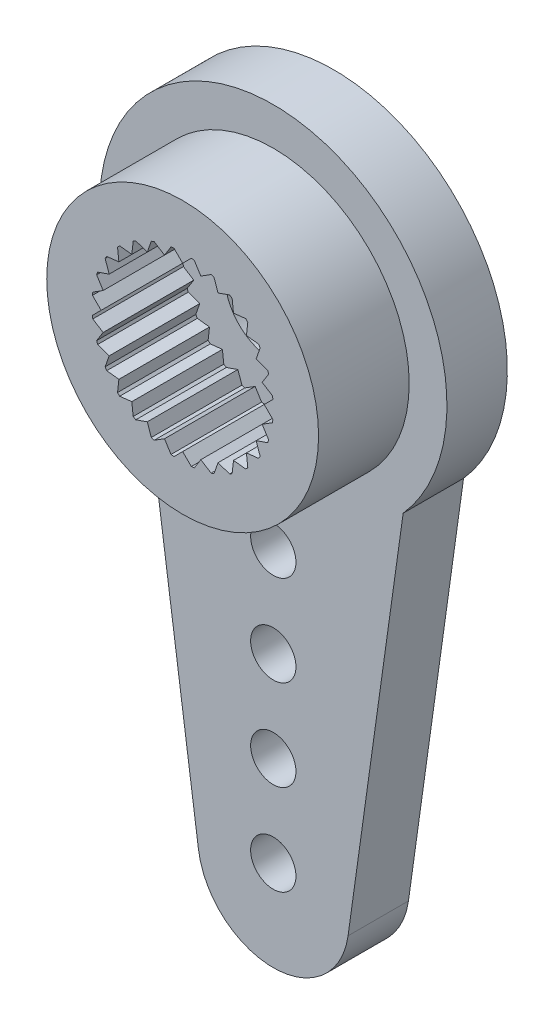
SolidWorks part; units mm, degrees
ref_plane "Plan de face" through (0, 0, 0) normal (0, 0, 1) x (1, 0, 0)
ref_plane "Plan de dessus" through (0, 0, 0) normal (0, 1, 0) x (1, 0, 0)
ref_plane "Plan de droite" through (0, 0, 0) normal (1, 0, 0) x (0, 0, -1)
sketch "Esquisse1" plane through (0, 0, 0) normal (0, 0, 1) x (1, 0, 0)
  circle A0 centre (0, 0) radius 5.75
  circle A1 centre (0, 0) radius 1.6
  dimension "D1" = 11.5
  dimension "D2" = 3.2
extrude "Boss.-Extru.1" add sketch "Esquisse1" along normal blind 5
sketch "Esquisse2" plane through (0, 0, 5) normal (0, 0, 1) x (1, 0, 0)
  circle A0 centre (0, 0) radius 3
  dimension "D1" = 6
extrude "Enlèv. mat.-Extru.1" cut sketch "Esquisse2" against normal blind 3
sketch "Esquisse3" plane through (0, 0, 5) normal (0, 0, 1) x (1, 0, 0)
  circle A0 centre (0, 0) radius 5.75
  circle A1 centre (0, 0) radius 4.5
  circle A2 centre (0, 0) radius 3 construction
  circle A3 centre (0, 0) radius 5.75 construction
  dimension "D1" = 1.5
extrude "Enlèv. mat.-Extru.2" cut sketch "Esquisse3" against normal blind 3
sketch "Esquisse4" plane through (0, 0, 0) normal (0, 0, -1) x (-1, 0, 0)
  line L0 (-4.3, 3.8174) -> (-2.4759, 16.8466)
  line L1 (2.4759, 16.8466) -> (4.3, 3.8174)
  line L2 (-5.2729, 19) -> (6.8365, 19) construction
  line L3 (0, 0) -> (0, 24.2526) construction
  circle A0 centre (0, 0) radius 5.75 construction
  arc A1 (-2.4759, 16.8466) -> (2.4759, 16.8466) centre (0, 16.5) cw
  arc A2 (-4.3, 3.8174) -> (4.3, 3.8174) centre (0, 0) cw
  dimension "D2" = 2.5
  dimension "D1" = 8.6
  dimension "D3" = 19
extrude "Boss.-Extru.2" add sketch "Esquisse4" against normal up to surface (2 mm away)
pattern_circular "Répétition circulaire1" count 2 every 180 about axis through (0, 0, 0) along (0, 0, 1) of "Boss.-Extru.2"
sketch "Esquisse5" plane through (0, 0, 0) normal (0, 0, -1) x (-1, 0, 0)
  line L0 (0, 0) -> (0, 20.4605) construction
  circle A0 centre (0, 7) radius 0.75
  circle A1 centre (0, 10) radius 0.75
  circle A2 centre (0, 13) radius 0.75
  circle A3 centre (0, 16) radius 0.75
  dimension "D5" = 1.5
  dimension "D6" = 1.5
  dimension "D7" = 1.5
  dimension "D8" = 1.5
  dimension "D1" = 7
  dimension "D2" = 3
  dimension "D3" = 3
  dimension "D4" = 3
extrude "Enlèv. mat.-Extru.3" cut sketch "Esquisse5" against normal blind 3
pattern_circular "Répétition circulaire2" count 2 every 180 about axis through (0, 0, 0) along (0, 0, 1) of "Enlèv. mat.-Extru.3"
sketch "Esquisse6" plane through (0, 0, 5) normal (0, 0, 1) x (1, 0, 0)
  line L0 (-1.598, 3) -> (1.8482, 3) construction
  line L1 (0, 0) -> (0, 5.9454) construction
  line L2 (-0.3, 3) -> (0, 2.7)
  line L3 (0, 2.7) -> (0.3, 3)
  line L4 (0.3, 3) -> (-0.3, 3)
  circle A0 centre (0, 0) radius 3 construction
  dimension "D1" = 0.3
  dimension "D2" = 0.6
extrude "Boss.-Extru.3" add sketch "Esquisse6" against normal up to surface (3 mm away)
pattern_circular "Répétition circulaire3" count 28 over 360 about axis through (0, 0, 0) along (0, 0, 1) of "Boss.-Extru.3"
sketch "Esquisse7" plane through (0, 0, 0) normal (0, 0, -1) x (-1, 0, 0)
  circle A0 centre (0, 0) radius 1.6
  circle A1 centre (0, 0) radius 3
  circle A2 centre (0, 0) radius 1.6 construction
  dimension "D1" = 6
extrude "Enlèv. mat.-Extru.4" cut sketch "Esquisse7" against normal blind 1
sketch "Esquisse8" plane through (0, 0, 0) normal (0, 0, -1) x (-1, 0, 0)
  circle A0 centre (0, 0) radius 3.4
  circle A1 centre (0, 0) radius 4.7
  circle A2 centre (0, 0) radius 3 construction
  dimension "D1" = 0.4
  dimension "D2" = 1.3
extrude "Enlèv. mat.-Extru.5" cut sketch "Esquisse8" against normal blind 1
sketch "Sketch1" plane through (0, 0, 0) normal (0, 0, -1) x (-1, 0, 0)
  line L1 (-4.3, 3.8174) -> (4.797, 3.8174)
  line L2 (-4.3, 3.8174) -> (-4.3, 20.07)
  line L3 (-4.3, 20.07) -> (4.797, 20.07)
  line L4 (4.797, 3.8174) -> (4.797, 20.07)
  circle A0 centre (0, 0) radius 5.75
extrude "Cut-Extrude1" cut sketch "Sketch1" against normal blind 10 contours A0 M11 M12 M13 M7 M9 M8 M6
